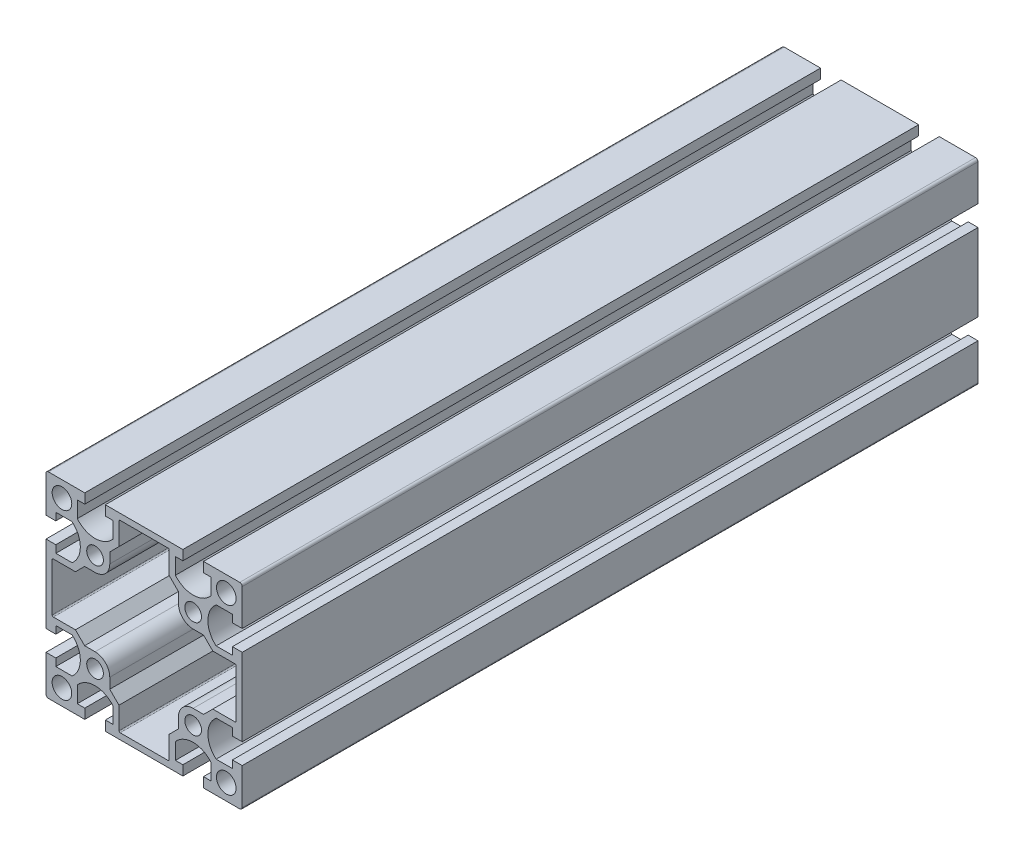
SolidWorks part; units mm, degrees
ref_plane "前视基准面" through (0, 0, 0) normal (0, 0, 1) x (1, 0, 0)
ref_plane "上视基准面" through (0, 0, 0) normal (0, 1, 0) x (1, 0, 0)
ref_plane "右视基准面" through (0, 0, 0) normal (1, 0, 0) x (0, 0, -1)
sketch "草图1"
sketch_block_instance "A$C16E17764-1"
sketch_block "A$C16E17764"
extrude "凸台-拉伸2" add sketch "草图1" along normal mid plane 300
